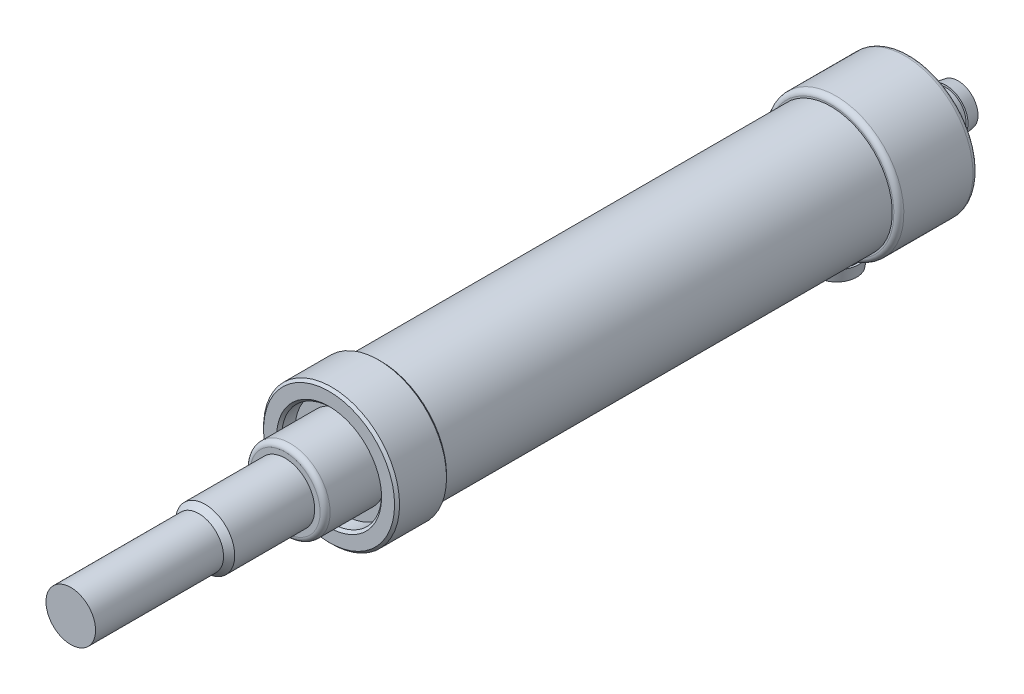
SolidWorks part; units mm, degrees
ref_plane "Plane1" through (0, 0, 0) normal (0, 0, 1) x (1, 0, 0)
ref_plane "Plane2" through (0, 0, 0) normal (0, 1, 0) x (1, 0, 0)
ref_plane "Plane3" through (0, 0, 0) normal (1, 0, 0) x (0, 0, -1)
sketch "Sketch1" plane through (0, 0, 0) normal (0, 0, 1) x (1, 0, 0)
  circle A0 centre (0, 0) radius 19.4945
  dimension "D1" = 38.989
extrude "Base-Extrude" add sketch "Sketch1" along normal blind 142.875
sketch "Sketch2" plane through (0, 0, 142.875) normal (0, 0, 1) x (1, 0, 0)
  circle A2 centre (0, 0) radius 21.59
  dimension "D1" = 43.18
extrude "Boss-Extrude1" add sketch "Sketch2" along normal blind 16.51
sketch "Sketch3" plane through (0, 0, 159.385) normal (0, 0, 1) x (1, 0, 0)
  circle A0 centre (0, 0) radius 15.875
  circle A1 centre (0, 0) radius 21.59 construction
  dimension "D1" = 31.75
extrude "Cut-Extrude1" cut sketch "Sketch3" against normal blind 5.08
sketch "Sketch4" plane through (0, 0, 154.305) normal (0, 0, 1) x (1, 0, 0)
  circle A0 centre (0, 0) radius 12.7
  circle A1 centre (0, 0) radius 15.875 construction
  dimension "D1" = 25.4
extrude "Boss-Extrude2" add sketch "Sketch4" along normal blind 19.05
fillet "Fillet1" radius 1.5875
chamfer "Chamfer1" distance 0.7937 angle 45
chamfer "Chamfer2" distance 0.7937 angle 45
chamfer "Chamfer3" distance 0.7937 angle 45
sketch "Sketch5" plane through (0, 0, 0) normal (0, 0, -1) x (-1, 0, 0)
  line L0 (21.59, 0) -> (21.59, -21.59)
  line L1 (0, -21.59) -> (21.59, -21.59)
  arc A0 (21.59, 0) -> (0, -21.59) centre (0, 0) ccw
  dimension "D1" = 43.18
extrude "Boss-Extrude3" add sketch "Sketch5" along normal blind 25.146
fillet "Fillet2" radius 1.5875
sketch "Sketch6" plane through (0, 0, -25.146) normal (0, 0, -1) x (-1, 0, 0)
  circle A0 centre (0, 0) radius 6.35
  arc A1 (20.0025, 0) -> (0, -20.0025) centre (0, 0) ccw construction
  dimension "D1" = 12.7
extrude "Boss-Extrude4" add sketch "Sketch6" along normal blind 3.81
sketch "Sketch7" plane through (0, 0, -28.956) normal (0, 0, -1) x (-1, 0, 0)
  circle A0 centre (0, 0) radius 6.985
  circle A1 centre (0, 0) radius 6.35 construction
  dimension "D1" = 13.97
extrude "Boss-Extrude5" add sketch "Sketch7" along normal blind 3.81 draft 9.462
pattern_linear "LPattern1" count 3 spacing 3.81
sketch "Sketch11" plane through (0, -21.59, 0) normal (0, -1, 0) x (1, 0, 0)
  line L2 (-20.0025, -23.5585) -> (0, -23.5585) construction
  line L6 (0, -23.5585) -> (0, -1.5875) construction
  circle A0 centre (-11.557, -13.3985) radius 6.35
  dimension "D2" = 12.7
  dimension "D1" = 11.557
  dimension "D3" = 10.16
extrude "Boss-Extrude8" add sketch "Sketch11" along normal blind 3.81
sketch "Sketch12" plane through (0, -25.4, 0) normal (0, -1, 0) x (1, 0, 0)
  circle A0 centre (-11.557, -13.3985) radius 6.985
  circle A1 centre (-11.557, -13.3985) radius 6.35 construction
  dimension "D1" = 13.97
extrude "Boss-Extrude9" add sketch "Sketch12" along normal blind 3.81 draft 9.462
pattern_linear "LPattern2" count 3 spacing 3.81
sketch "Sketch13" plane through (0, -36.83, 0) normal (0, -1, 0) x (1, 0, 0)
  circle A0 centre (-11.557, -13.3985) radius 5.0419
  circle A1 centre (-11.557, -13.3985) radius 6.35 construction
  dimension "D1" = 10.0838
extrude "Cut-Extrude2" cut sketch "Sketch13" against normal blind 25.4
sketch "Sketch14" plane through (0, 0, -40.386) normal (0, 0, -1) x (-1, 0, 0)
  circle A0 centre (0, 0) radius 5.0419
  circle A2 centre (0, 0) radius 6.35 construction
  dimension "D1" = 10.0838
extrude "Cut-Extrude3" cut sketch "Sketch14" against normal blind 25.4
sketch "Sketch15" plane through (0, 0, 0) normal (1, 0, 0) x (0, 0, -1)
  line L0 (0, 0) -> (-263.1198, 0) construction
  line L1 (-142.875, 0) -> (0, 0) construction
  line L2 (-173.355, 0) -> (-173.355, 9.398)
  line L3 (-173.355, 9.398) -> (-198.755, 9.398)
  line L4 (-198.755, 9.398) -> (-200.787, 7.874)
  line L5 (-200.787, 7.874) -> (-241.427, 7.874)
  line L6 (-241.427, 7.874) -> (-241.427, 0)
  line L7 (-241.427, 0) -> (-173.355, 0)
  line L8 (-173.355, 11.1125) -> (-173.355, -11.1125) construction
  dimension "D1" = 9.398
  dimension "D2" = 25.4
  dimension "D3" = 40.64
  dimension "D4" = 7.874
  dimension "D5" = 2.54
revolve "Connector" add sketch "Sketch15" angle 360 about L0
